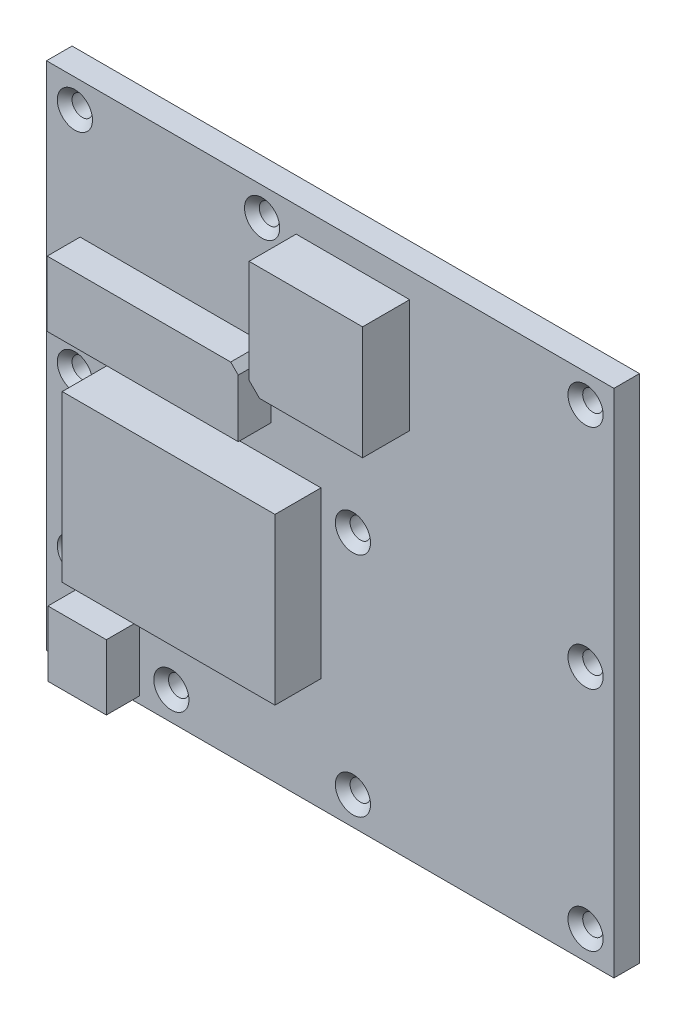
SolidWorks part; units mm, degrees
ref_plane "Front" through (0, 0, 0) normal (0, 0, 1) x (1, 0, 0)
ref_plane "Top" through (0, 0, 0) normal (0, 1, 0) x (1, 0, 0)
ref_plane "Right" through (0, 0, 0) normal (1, 0, 0) x (0, 0, -1)
sketch "Эскиз1" plane through (0, 0, 0) normal (0, 0, 1) x (1, 0, 0)
  line L0 (127.0005, 48) -> (127.0005, -42)
  line L2 (127.0005, -42) -> (27.0005, -42)
  line L4 (27.0005, 48) -> (127.0005, 48)
  line L6 (-190, 150) -> (190, 150) construction
  line L9 (27.0005, 48) -> (27.0005, -42)
  dimension "D1" = 100
  dimension "D2" = 27.0005
  dimension "D3" = 102
  dimension "D4" = 90
extrude "Бобышка-Вытянуть1" add sketch "Эскиз1" along normal blind 4.5
sketch "Эскиз2" plane through (0, 0, 4.5) normal (0, 0, 1) x (1, 0, 0)
  line L0 (75.3631, 6.9907) -> (75.3631, -25.0093) construction
  line L1 (37.8631, 6.9907) -> (75.3631, 6.9907)
  line L2 (37.8631, 6.9907) -> (37.8631, -22.1302)
  line L3 (37.8631, -22.1302) -> (75.3631, -22.1302)
  line L4 (75.3631, 6.9907) -> (75.3631, -22.1302)
  line L6 (27.0005, 48) -> (27.0005, -42) construction
  line L7 (27.0005, -42) -> (127.0005, -42) construction
  dimension "D1" = 10.8626
  dimension "D2" = 19.8698
extrude "Бобышка-Вытянуть2" add sketch "Эскиз2" along normal blind 8.1
sketch "Эскиз3" plane through (0, 0, 4.5) normal (0, 0, 1) x (1, 0, 0)
  line L0 (27.0005, 48) -> (27.0005, -42) construction
  line L1 (70.9971, 43.5357) -> (90.9971, 43.5357)
  line L2 (70.9971, 43.5357) -> (70.9971, 23.5357)
  line L3 (70.9971, 23.5357) -> (90.9971, 23.5357)
  line L4 (90.9971, 43.5357) -> (90.9971, 23.5357)
  line L5 (127.0005, 48) -> (27.0005, 48) construction
  dimension "D1" = 43.9966
  dimension "D2" = 4.4643
  dimension "D3" = 20
  dimension "D4" = 20
extrude "Бобышка-Вытянуть3" add sketch "Эскиз3" along normal blind 8.3
sketch "Эскиз4" plane through (0, 0, 4.5) normal (0, 0, 1) x (1, 0, 0)
  line L0 (32.9209, 24.0458) -> (66.5891, 24.0458)
  line L1 (66.5891, 24.0458) -> (66.5891, 12.5456)
  line L2 (66.5891, 12.5456) -> (32.9209, 12.5456)
  line L3 (32.9209, 12.5456) -> (32.9209, 24.0458)
  line L6 (42.796, 12.5456) -> (33.3462, 12.5456) construction
  line L8 (33.0479, -29.2942) -> (43.3481, -29.2942)
  line L9 (43.3481, -29.2942) -> (43.3481, -40.7944)
  line L10 (43.3481, -40.7944) -> (33.0479, -40.7944)
  line L11 (33.0479, -40.7944) -> (33.0479, -29.2942)
  line L15 (127.0005, 48) -> (27.0005, 48) construction
  line L16 (27.0005, 48) -> (27.0005, -42) construction
  line L17 (27.0005, -42) -> (127.0005, -42) construction
  dimension "D1" = 23.9542
  dimension "D2" = 5.9204
  dimension "D3" = 33.6682
  dimension "D4" = 6.0474
  dimension "D5" = 10.3002
  dimension "D6" = 1.2056
extrude "Бобышка-Вытянуть4" add sketch "Эскиз4" along normal blind 5.8
sketch "Эскиз5" plane through (0, 0, 4.5) normal (0, 0, 1) x (1, 0, 0)
  line L0 (21.5557, 43) -> (127.6806, 43) construction
  line L1 (32.0005, 48) -> (32.0005, -42) construction
  line L2 (127.0005, 48) -> (27.0005, 48) construction
  line L3 (27.0005, -42) -> (127.0005, -42) construction
  line L4 (24.9937, -37) -> (92.232, -37) construction
  line L6 (122.0005, 48) -> (122.0005, -37) construction
  line L7 (127.0005, -42) -> (127.0005, 48) construction
  line L8 (64.9971, 53.1514) -> (64.9971, 33.8623) construction
  line L9 (70.9971, 43.5357) -> (70.9971, 23.5357) construction
  line L10 (19.0017, 3) -> (134.3486, 3) construction
  line L12 (49.0005, -29.485) -> (49.0005, -47.7681) construction
  line L13 (81.0005, 15.484) -> (81.0005, -47.7681) construction
  line L17 (27.0005, 48) -> (27.0005, -42) construction
  line L18 (27.0005, 48) -> (127.0005, 48) construction
  circle A0 centre (122.0005, 43) radius 1.8
  circle A1 centre (64.9971, 43) radius 1.8
  circle A2 centre (32.0005, 43) radius 1.8
  circle A3 centre (81.0005, 3) radius 1.8
  circle A4 centre (122.0005, 3) radius 1.8
  circle A5 centre (49.0005, -37) radius 1.8
  circle A6 centre (122.0005, -37) radius 1.8
  circle A7 centre (32.0005, 3) radius 1.8
  circle A8 centre (81.0005, -37) radius 1.8
  circle A9 centre (32.0005, -25.0297) radius 1.8
  dimension "D7" = 3.6
  dimension "D9" = 3.6
  dimension "D11" = 3.6
  dimension "D12" = 3.6
  dimension "D1" = 5
  dimension "D2" = 5
  dimension "D3" = 5
  dimension "D4" = 5
  dimension "D5" = 6
  dimension "D6" = 22
  dimension "D8" = 54
  dimension "D10" = 45
extrude "Вырез-Вытянуть1" cut sketch "Эскиз5" against normal through all
sketch "Эскиз6" plane through (0, 0, 12.8) normal (0, 0, 1) x (1, 0, 0)
  line L0 (66.5891, 24.0458) -> (70.9971, 24.0458) construction
  line L1 (70.9971, 43.5357) -> (70.9971, 23.5357) construction
  line L2 (68.7931, 24.0458) -> (68.7931, 27.7364) construction
  line L3 (68.6426, 27.7319) -> (73.4997, 22.8747)
  line L4 (65.107, 24.1963) -> (69.9642, 19.3392)
  line L5 (66.5891, 12.5456) -> (66.5891, 24.0458) construction
  line L6 (65.107, 24.1963) -> (68.6426, 27.7319)
  line L7 (73.4997, 22.8747) -> (69.9642, 19.3392)
  dimension "D1" = 45
  dimension "D2" = 2.204
  dimension "D3" = 2.5
  dimension "D4" = 2.5
extrude "Вырез-Вытянуть2" cut sketch "Эскиз6" against normal up to surface (8.3 mm away)
chamfer "Фаска1" distance 1.3 angle 45 10 edges at (33.8005, 43, 4.5) (66.7971, 43, 4.5) (123.8005, 43, 4.5) (123.8005, 3, 4.5) (82.8005, 3, 4.5) (123.8005, -37, 4.5) (82.8005, -37, 4.5) (33.8005, 3, 4.5) (50.8005, -37, 4.5) (33.8005, -25.0297, 4.5)
